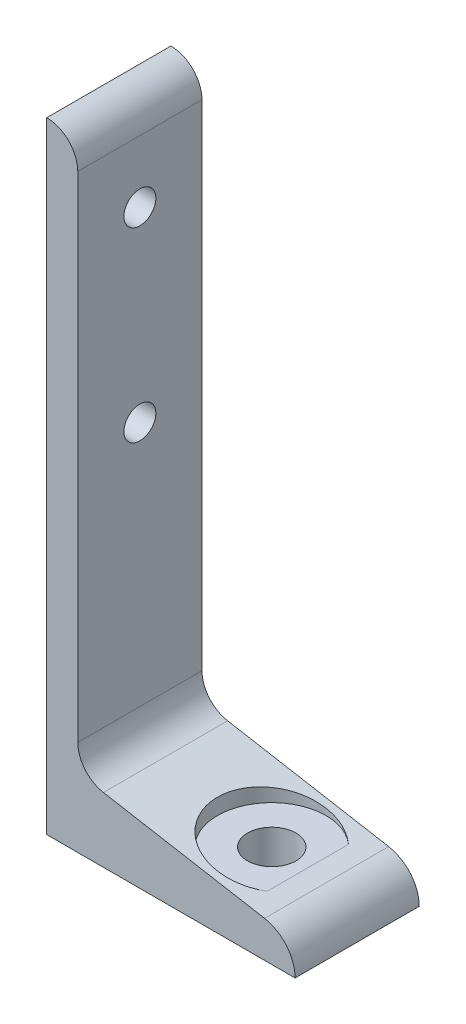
SolidWorks part; units mm, degrees
ref_plane "Front Plane" through (0, 0, 0) normal (0, 0, 1) x (1, 0, 0)
ref_plane "Top Plane" through (0, 0, 0) normal (0, 1, 0) x (1, 0, 0)
ref_plane "Right Plane" through (0, 0, 0) normal (1, 0, 0) x (0, 0, -1)
sketch "Sketch1" plane through (0, 0, 0) normal (0, 0, 1) x (1, 0, 0)
  line L0 (0, 0) -> (0, 127)
  line L1 (6.35, 127) -> (6.35, 120.65) construction
  line L2 (6.35, 120.65) -> (6.35, 19.516)
  line L3 (11.5973, 13.2625) -> (44.5465, 7.4527)
  line L4 (6.35, 127) -> (0, 127) construction
  line L5 (50.8, 0) -> (0, 0)
  line L6 (44.5465, 7.4527) -> (50.8, 6.35) construction
  line L7 (50.8, 6.35) -> (50.8, 0) construction
  arc A0 (6.35, 120.65) -> (0, 127) centre (0, 120.65) ccw
  arc A1 (50.8, 0) -> (44.5465, 7.4527) centre (43.2324, 0) ccw
  arc A2 (6.35, 19.516) -> (11.5973, 13.2625) centre (12.7, 19.516) ccw
  point P2 (6.35, 123.825)
  dimension "D1" = 10
  dimension "E" = 6.35
  dimension "Er" = 6.35
  dimension "Dr" = 6.35
  dimension "A" = 127
  dimension "F" = 50.8
extrude "Boss-Extrude1" add sketch "Sketch1" along normal mid plane 25.4
sketch "Sketch2" plane through (0, 0, 0) normal (0, 1, 0) x (1, 0, 0)
  line L0 (0, -12.7) -> (50.8, -12.7) construction
  line L2 (33.3248, 0) -> (0, 0) construction
  line L3 (0, -12.7) -> (0, 12.7) construction
  line L4 (33.3248, 0) -> (33.3248, 25.4) construction
  line L5 (50.8, -12.7) -> (50.8, 12.7) construction
  circle A0 centre (33.3248, 0) radius 4.953
  circle A1 centre (33.3248, 0) radius 11.1125 construction
extrude "Cut-Extrude1" cut sketch "Sketch2" along normal through all
sketch "Sketch3" plane through (0, 0, 0) normal (0, 1, 0) x (1, 0, 0)
  circle A1 centre (33.3248, 0) radius 11.1125 construction
  circle A2 centre (33.3248, 0) radius 11.1125
extrude "Cut-Extrude2" cut sketch "Sketch3" along normal through all from offset 8.128
sketch "Sketch4" plane through (0, 0, 0) normal (1, 0, 0) x (0, 0, -1)
  line L0 (0, 0) -> (0, 69.85) construction
  line L1 (0, 69.85) -> (0, 107.95) construction
  line L2 (0, 107.95) -> (25.4, 107.95) construction
  circle A0 centre (0, 69.85) radius 3.2639
  circle A1 centre (0, 107.95) radius 3.2639
extrude "Cut-Extrude3" cut sketch "Sketch4" along normal through all
pattern_linear "LPattern1" [suppressed] count 2 spacing 25.4 along (0, 0, -1)
pattern_linear "LPattern2" [suppressed] count 2 spacing 25.4 along (0, 0, -1)
equation "\"D3@LPattern1\" = \"H@Sketch2\""
equation "\"D3@LPattern2\" = \"D@Sketch4\""
